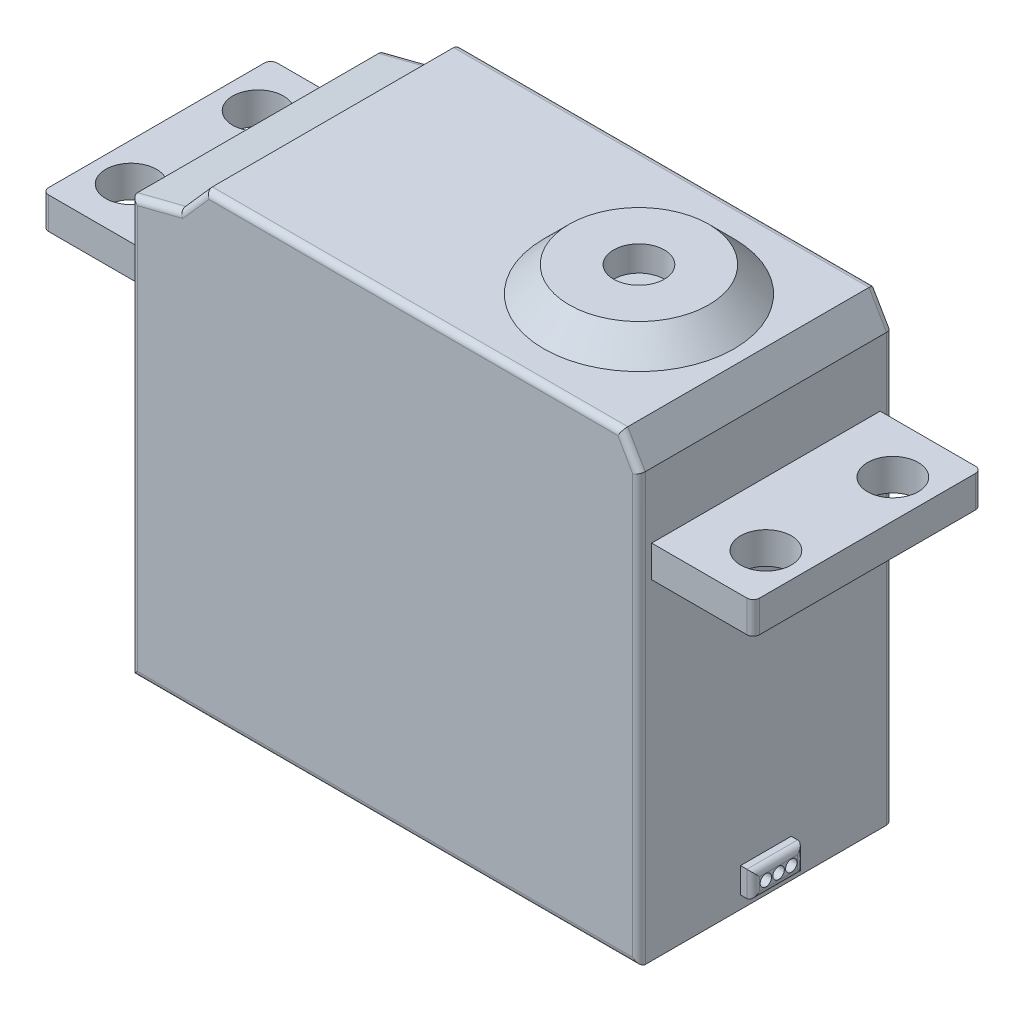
SolidWorks part; units mm, degrees
ref_plane "Plan de face" through (0, 0, 0) normal (0, 0, 1) x (1, 0, 0)
ref_plane "Plan de dessus" through (0, 0, 0) normal (0, 1, 0) x (1, 0, 0)
ref_plane "Plan de droite" through (0, 0, 0) normal (1, 0, 0) x (0, 0, -1)
sketch "Esquisse1" plane through (0, 0, 0) normal (0, 1, 0) x (1, 0, 0)
  line L1 (-20, -10) -> (20, -10)
  line L2 (-20, -10) -> (-20, 10)
  line L3 (-20, 10) -> (20, 10)
  line L4 (20, -10) -> (20, 10)
  dimension "D1" = 40
  dimension "D2" = 20
  dimension "D3" = 20
  dimension "D4" = 10
extrude "Extrusion1" add sketch "Esquisse1" along normal blind 36
ref_plane "Plan1" through (0, 26, 0) normal (0, -1, 0) x (1, 0, 0)
sketch "Esquisse2" plane through (0, 26, 0) normal (0, -1, 0) x (1, 0, 0)
  line L1 (20, 9) -> (28, 9)
  line L2 (20, 9) -> (20, -9)
  line L3 (20, -9) -> (28, -9)
  line L4 (28, 9) -> (28, -9)
  line L5 (-20, 9) -> (-28, 9)
  line L6 (-20, 9) -> (-20, -9)
  line L7 (-20, -9) -> (-28, -9)
  line L8 (-28, 9) -> (-28, -9)
  line L9 (-20, 10) -> (20, 10) construction
  line L10 (20, -10) -> (-20, -10) construction
  line L11 (20, 10) -> (20, -10) construction
  line L12 (-20, -10) -> (-20, 10) construction
  circle A0 centre (25, 5) radius 2
  circle A1 centre (25, -5) radius 2
  circle A2 centre (-25, 5) radius 2
  circle A3 centre (-25, -5) radius 2
  dimension "D2" = 4
  dimension "D1" = 8
  dimension "D3" = 3
  dimension "D4" = 3
  dimension "D5" = 4
  dimension "D6" = 4
  dimension "D7" = 1
  dimension "D8" = 1
extrude "Extrusion2" add sketch "Esquisse2" against normal blind 2.5
sketch "Esquisse3" plane through (0, 0, -10) normal (0, 0, -1) x (-1, 0, 0)
  line L0 (14.1004, 36) -> (16.1985, 33.6232)
  line L1 (-20, 36) -> (20, 36) construction
  line L2 (16.1985, 33.6232) -> (20, 32.6544)
  line L3 (20, 36) -> (20, 0) construction
  line L4 (20, 32.6544) -> (20, 36)
  line L5 (20, 36) -> (14.1004, 36)
  line L6 (-18.6207, 36) -> (-20, 33.6232)
  line L7 (-20, 36) -> (-20, 0) construction
  line L8 (-20, 33.6232) -> (-20, 36)
  line L9 (-20, 36) -> (-18.6207, 36)
extrude "Enlèv. mat.-Extru.1" cut sketch "Esquisse3" against normal through all
sketch "Esquisse4" plane through (0, 36, 0) normal (0, 1, 0) x (-1, 0, 0)
  line L0 (-20, 10) -> (-20, -10) construction
  line L1 (-18.6207, -10) -> (14.1004, -10) construction
  circle A0 centre (-10, 0) radius 7.5
  circle A1 centre (-10, 0) radius 2
  dimension "D2" = 15
  dimension "D3" = 4
  dimension "D1" = 10
  dimension "D4" = 10
extrude "Extrusion3" add sketch "Esquisse4" along normal blind 2
chamfer "Chanfrein1" distance 2 angle 45 1 edges at (10, 38, 7.5)
sketch "Esquisse5" plane through (20, 0, 0) normal (1, 0, 0) x (0, 0, -1)
  line L0 (-10, 0) -> (10, 0) construction
  line L1 (-2, 3) -> (2, 3)
  line L2 (-2, 3) -> (-2, 1)
  line L3 (-2, 1) -> (2, 1)
  line L4 (2, 3) -> (2, 1)
  circle A0 centre (0, 2) radius 0.45
  circle A1 centre (-1, 2) radius 0.45
  circle A2 centre (1, 2) radius 0.45
  dimension "D3" = 0.9
  dimension "D1" = 1
  dimension "D2" = 1
  dimension "D4" = 4
  dimension "D5" = 1
  dimension "D6" = 1
  dimension "D7" = 2
  dimension "D8" = 1
extrude "Extrusion4" add sketch "Esquisse5" along normal blind 1
fillet "Congé1" radius 0.5 22 edges at (-28, 27.25, -9) (-28, 27.25, 9) (28, 27.25, 9) (28, 27.25, -9) (0, 0, 10) (-20, 16.3272, 10) (-18.0993, 33.1388, 10) (-15.1494, 34.8116, 10) (2.2602, 36, 10) (19.3104, 34.8116, 10) (20, 16.8116, 10) (-15.1494, 34.8116, -10) (-18.0993, 33.1388, -10) (-20, 16.3272, -10) (0, 0, -10) (20, 16.8116, -10) (19.3104, 34.8116, -10) (2.2602, 36, -10) (21, 1, 0) (21, 2, 2) (21, 3, 0) (21, 2, -2)
